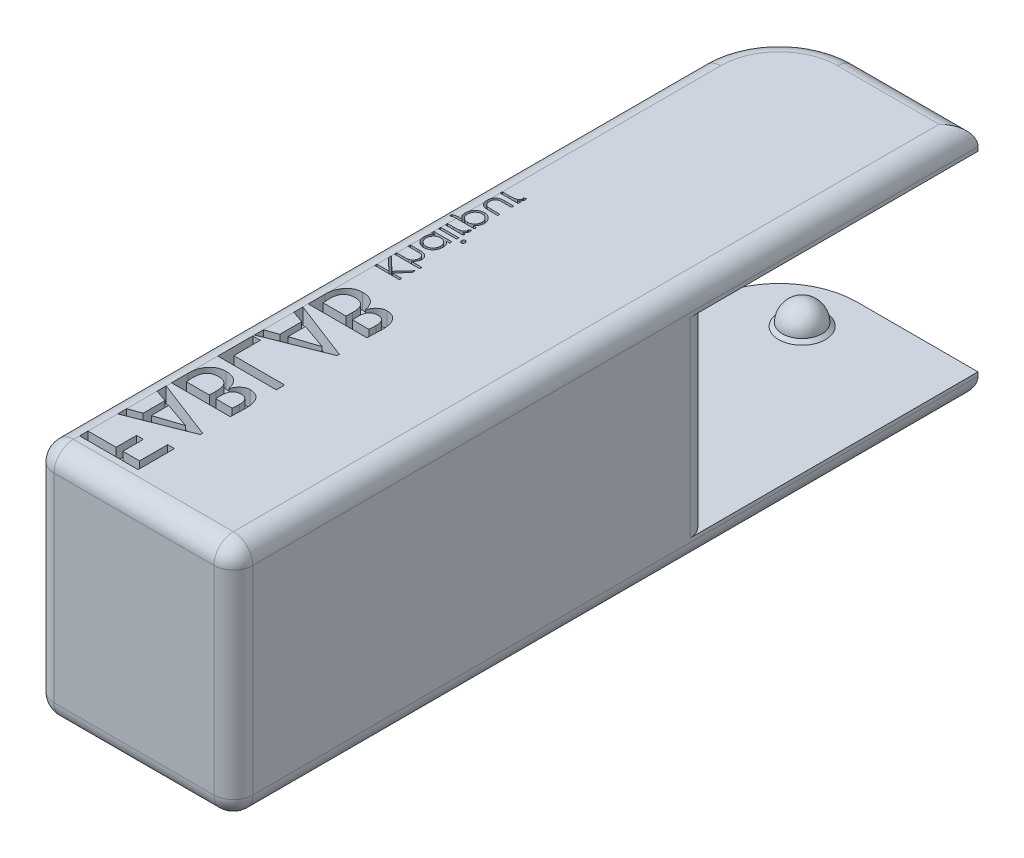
SolidWorks part; units mm, degrees
ref_plane "Front Plane" through (0, 0, 0) normal (0, 0, 1) x (1, 0, 0)
ref_plane "Top Plane" through (0, 0, 0) normal (0, 1, 0) x (1, 0, 0)
ref_plane "Right Plane" through (0, 0, 0) normal (1, 0, 0) x (0, 0, -1)
sketch "Sketch9" plane through (0, 0, 0) normal (0, 0, 1) x (1, 0, 0)
  line L1 (0, 0) -> (22.5, 0)
  line L2 (0, 0) -> (0, 24.5)
  line L3 (0, 24.5) -> (22.5, 24.5)
  line L4 (22.5, 0) -> (22.5, 24.5)
  dimension "D1" = 22.5
  dimension "D2" = 24.5
extrude "Extrude-Thin5" add sketch "Sketch9" against normal blind 92.5 thin
sketch "Sketch10" plane through (0, 0, 0) normal (0, 0, 1) x (1, 0, 0)
  line L1 (-3, 27.5) -> (25.5, 27.5)
  line L2 (-3, 27.5) -> (-3, -3)
  line L3 (-3, -3) -> (25.5, -3)
  line L4 (25.5, 27.5) -> (25.5, -3)
extrude "Boss-Extrude3" add sketch "Sketch10" along normal blind 3
sketch "Sketch14" plane through (25.5, 0, 0) normal (1, 0, 0) x (0, 0, -1)
  line L1 (-3, 27.5) -> (92.5, 27.5)
  line L2 (-3, 27.5) -> (-3, -3)
  line L3 (-3, -3) -> (92.5, -3)
  line L4 (92.5, 27.5) -> (92.5, -3)
extrude "Cut-Extrude6" cut sketch "Sketch14" against normal blind 3
sketch "Sketch16" plane through (0, 0, 0) normal (1, 0, 0) x (0, 0, -1)
  line L0 (92.5, 0) -> (0, 0) construction
  line L1 (92.5, 24.5) -> (58.036, 24.5)
  line L2 (92.5, 24.5) -> (92.5, 0)
  line L3 (92.5, 0) -> (58.036, 0)
  line L4 (58.036, 24.5) -> (58.036, 0)
extrude "Cut-Extrude8" cut sketch "Sketch16" against normal blind 3
sketch "Sketch17" plane through (0, 0, 0) normal (0, 1, 0) x (1, 0, 0)
  line L0 (4.2, 92.5) -> (22.5, 80.1) construction
  line L1 (22.5, 92.5) -> (4.2, 92.5)
  line L2 (22.5, 92.5) -> (22.5, 80.1)
  line L3 (22.5, 80.1) -> (4.2, 80.1)
  line L4 (4.2, 92.5) -> (4.2, 80.1)
  circle A0 centre (13.35, 86.3) radius 3
  dimension "D4" = 6
  dimension "D1" = 12.4
  dimension "D2" = 18.3
sketch "Sketch35" plane through (0, 24.5, 0) normal (0, -1, 0) x (1, 0, 0)
  line L0 (4.2, -92.5) -> (22.5, -80.1) construction
  line L1 (22.5, -92.5) -> (4.2, -92.5)
  line L2 (22.5, -92.5) -> (22.5, -80.1)
  line L3 (22.5, -80.1) -> (4.2, -80.1)
  line L4 (4.2, -92.5) -> (4.2, -80.1)
  line L5 (22.5, -92.5) -> (4.2, -80.1) construction
  circle A0 centre (13.35, -86.3) radius 3
  dimension "D3" = 6
  dimension "D1" = 12.4
  dimension "D2" = 18.3
extrude "Boss-Extrude12" add sketch "Sketch35" along normal blind 0.4 draft 50 contours A0
sketch "Sketch36" plane through (0, 24.1, 0) normal (0, -1, 0) x (1, 0, 0)
  line L0 (13.35, -88.8233) -> (13.35, -83.7767)
  circle A0 centre (13.35, -86.3) radius 2.5233 construction
  arc A1 (13.35, -88.8233) -> (13.35, -83.7767) centre (13.35, -86.3) cw
revolve "Revolve6" add sketch "Sketch36" angle 180 about L0
sketch "Sketch38" plane through (0, 24.5, 0) normal (0, -1, 0) x (1, 0, 0)
  line L1 (22.5, 0) -> (8, 0)
  line L2 (22.5, 0) -> (22.5, -17.4)
  line L3 (22.5, -17.4) -> (8, -17.4)
  line L4 (8, 0) -> (8, -17.4)
  line L5 (8, -17.4) -> (22.5, 0) construction
  line L6 (15.25, -8.7) -> (8, -8.7) construction
  line L7 (15.25, -8.7) -> (15.25, 0) construction
  line L13 (15.25, -8.7) -> (22.5, -8.7) construction
  line L14 (22.5, -8.7) -> (15.25, 0) construction
  line L15 (18.875, -4.35) -> (15.25, -4.35) construction
  line L16 (18.875, -4.35) -> (18.875, 0) construction
  line L17 (18.875, 0) -> (15.25, -4.35) construction
  line L18 (18.0807, -0.9531) -> (16.0443, -3.3969)
  arc A1 (16.0443, -3.3969) -> (18.0807, -0.9531) centre (17.0625, -2.175) cw
  dimension "D1" = 17.4
  dimension "D2" = 14.5
fillet "Fillet5" radius 10 2 edges at (22.5, 26, -92.5) (22.5, -1.5, -92.5)
fillet "Fillet6" radius 2.5 13 edges at (-3, 12.25, 3) (9.75, -3, 3) (9.75, 27.5, 3) (22.5, 12.25, 3) (22.5, -3, -39.75) (-3, 27.5, -44.75) (-3, -3, -44.75) (-3, 12.25, -58.036) (4.75, -3, -92.5) (22.5, 27.5, -39.75) (19.5711, -3, -89.5711) (4.75, 27.5, -92.5) (19.5711, 27.5, -89.5711)
revolve "Cut-Revolve12" cut sketch "Sketch38" angle 180 about L18
sketch "Sketch39" plane through (0, 27.5, 0) normal (0, 1, 0) x (1, 0, 0)
  line L0 (20, -0.5) -> (20, 82.5) construction
  text T0 "FABLAB  " font "Trebuchet MS" height 7.5
  text T1 "         Khairpur"
extrude "Cut-Extrude12" cut sketch "Sketch39" against normal blind 2
extrude "Boss-Extrude13" add sketch "Sketch17" along normal blind 0.4 draft 50 contours A0 L0 | L0 A0
sketch "Sketch40" plane through (0, 0.4, 0) normal (0, 1, 0) x (1, 0, 0)
  line L0 (13.35, 83.7767) -> (13.35, 88.8233) construction
  line L1 (13.35, 88.8233) -> (13.35, 83.7767)
  circle A0 centre (13.35, 86.3) radius 2.5233 construction
  arc A1 (13.35, 88.8233) -> (13.35, 83.7767) centre (13.35, 86.3) cw
revolve "Revolve8" add sketch "Sketch40" angle 180 about L0
mirror "Mirror2" about plane through (22.5, 0, 0) normal (1, 0, 0)
delete or keep bodies "Body-Delete/Keep 2" type delete bodies bodies 185
